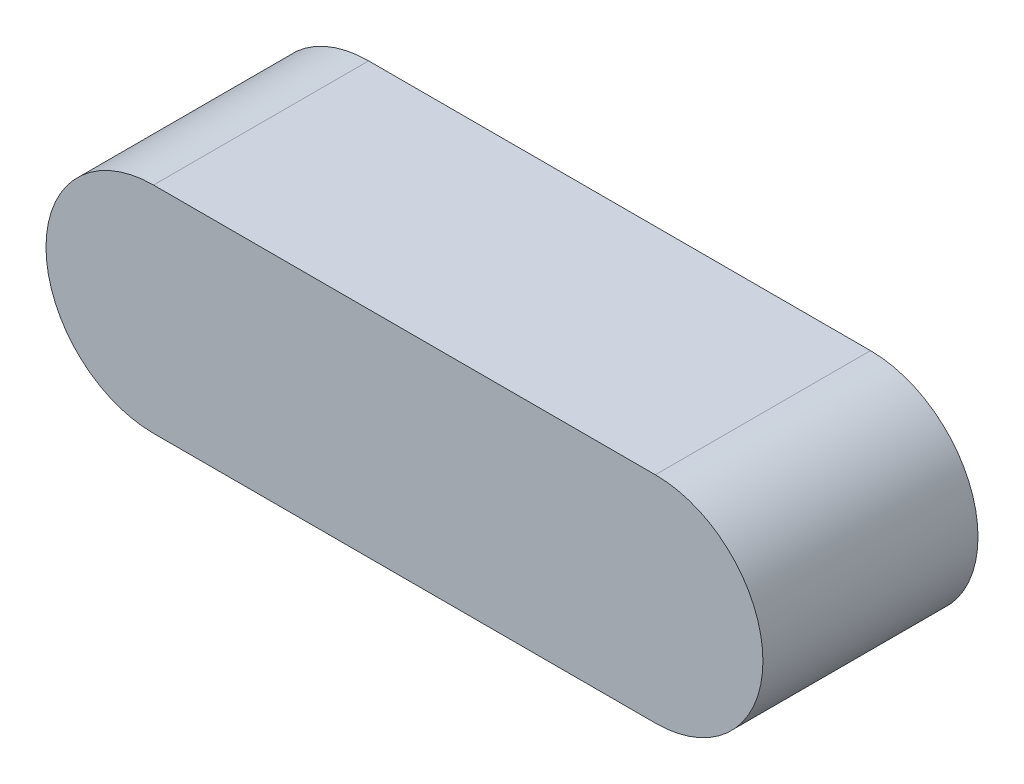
SolidWorks part; units mm, degrees
ref_plane "Plan de face" through (0, 0, 0) normal (0, 0, 1) x (1, 0, 0)
ref_plane "Plan de dessus" through (0, 0, 0) normal (0, 1, 0) x (1, 0, 0)
ref_plane "Plan de droite" through (0, 0, 0) normal (1, 0, 0) x (0, 0, -1)
sketch "Esquisse1" plane through (0, 0, 0) normal (0, 0, 1) x (1, 0, 0)
  line L1 (0, 0) -> (7, 0)
  line L3 (0, -3) -> (7, -3)
  arc A0 (0, 0) -> (0, -3) centre (0, -1.5) ccw
  arc A1 (7, 0) -> (7, -3) centre (7, -1.5) cw
  dimension "D2" = 1.5
  dimension "D1" = 7
extrude "Boss.-Extru.1" add sketch "Esquisse1" along normal blind 3
